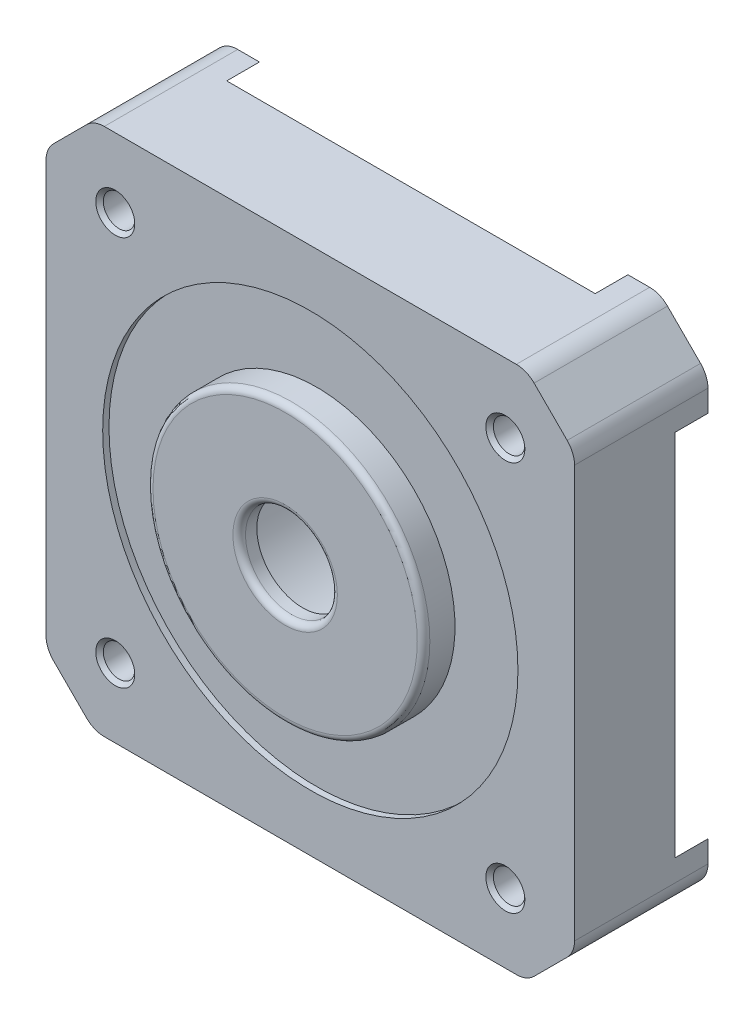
SolidWorks part; units mm, degrees
ref_plane "Front Plane" through (0, 0, 0) normal (0, 0, 1) x (1, 0, 0)
ref_plane "Top Plane" through (0, 0, 0) normal (0, 1, 0) x (1, 0, 0)
ref_plane "Right Plane" through (0, 0, 0) normal (1, 0, 0) x (0, 0, -1)
ref_plane "Plane1" through (0, 0, 34.2) normal (0, 0, -1) x (-1, 0, 0)
sketch "Sketch1" plane through (0, 0, 34.2) normal (0, 0, -1) x (-1, 0, 0)
  line L0 (27.5955, 125.6172) -> (-6.8045, 125.6172)
  line L1 (-6.8045, 125.6172) -> (-10.6045, 121.8172)
  line L2 (-10.6045, 121.8172) -> (-10.6045, 87.4172)
  line L3 (-10.6045, 87.4172) -> (-6.8045, 83.6172)
  line L4 (-6.8045, 83.6172) -> (27.5955, 83.6172)
  line L5 (27.5955, 83.6172) -> (31.3955, 87.4172)
  line L6 (31.3955, 87.4172) -> (31.3955, 121.8172)
  line L7 (31.3955, 121.8172) -> (27.5955, 125.6172)
extrude "Boss-Extrude1" add sketch "Sketch1" against normal blind 8
sketch "Sketch2" plane through (0, 0, 34.2) normal (0, 0, -1) x (-1, 0, 0)
  line L0 (-10.6045, 87.4172) -> (-10.6045, 89.9761)
  line L1 (-4.2455, 83.6172) -> (-6.8045, 83.6172)
  line L2 (-6.8045, 83.6172) -> (-10.6045, 87.4172)
  arc A0 (-10.6045, 89.9761) -> (-4.2455, 83.6172) centre (10.3955, 104.6172) ccw
extrude "Boss-Extrude2" add sketch "Sketch2" along normal blind 2.6
sketch "Sketch3" plane through (0, 0, 34.2) normal (0, 0, -1) x (-1, 0, 0)
  line L0 (27.5955, 83.6172) -> (25.0365, 83.6172)
  line L1 (31.3955, 89.9761) -> (31.3955, 87.4172)
  line L2 (31.3955, 87.4172) -> (27.5955, 83.6172)
  arc A0 (25.0365, 83.6172) -> (31.3955, 89.9761) centre (10.3955, 104.6172) ccw
extrude "Boss-Extrude3" add sketch "Sketch3" along normal blind 2.6
sketch "Sketch4" plane through (0, 0, 34.2) normal (0, 0, -1) x (-1, 0, 0)
  line L0 (31.3955, 121.8172) -> (31.3955, 119.2582)
  line L1 (25.0365, 125.6172) -> (27.5955, 125.6172)
  line L2 (27.5955, 125.6172) -> (31.3955, 121.8172)
  arc A0 (31.3955, 119.2582) -> (25.0365, 125.6172) centre (10.3955, 104.6172) ccw
extrude "Boss-Extrude4" add sketch "Sketch4" along normal blind 2.6
sketch "Sketch5" plane through (0, 0, 34.2) normal (0, 0, -1) x (-1, 0, 0)
  line L0 (-6.8045, 125.6172) -> (-4.2455, 125.6172)
  line L1 (-10.6045, 119.2582) -> (-10.6045, 121.8172)
  line L2 (-10.6045, 121.8172) -> (-6.8045, 125.6172)
  arc A0 (-4.2455, 125.6172) -> (-10.6045, 119.2582) centre (10.3955, 104.6172) ccw
extrude "Boss-Extrude5" add sketch "Sketch5" along normal blind 2.6
hole_wizard "M30 Clearance Hole1" positions "Sketch7" profile "Sketch6" hole size "M30" standard "ANSI Metric"
sketch "Sketch7" plane through (0, 0, 42.2) normal (0, 0, 1) x (1, 0, 0)
  point P0 (-10.3955, 104.6172)
sketch "Sketch6" plane through (-10.3955, 104.6172, 42.2) normal (1, 0, 0) x (0, -1, 0)
  line L0 (0, 0) -> (0, 10.6)
  line L1 (0, 10.6) -> (16.5, 10.6)
  line L2 (16.5, 10.6) -> (16.5, 0)
  line L5 (16.5, 0) -> (0, 0)
  line L11 (0, -6.35) -> (0, 107.95) construction
  dimension "Thru Hole Dia." = 33
  dimension "Thru Hole Depth" = 10.6
ref_plane "Plane2" through (0, 104.6172, 0) normal (0, -1, 0) x (1, 0, 0)
sketch "Sketch8" plane through (0, 104.6172, 0) normal (0, -1, 0) x (1, 0, 0)
  line L0 (0.6045, 44.2) -> (-10.3955, 44.2)
  line L1 (-10.3955, 44.2) -> (-10.3955, 41.7)
  line L2 (-10.3955, 41.7) -> (0.6045, 41.7)
  line L3 (0.6045, 41.7) -> (0.6045, 44.2)
  line L4 (-10.3955, 44.2) -> (-10.3955, 41.7) construction
revolve "Revolve1" add sketch "Sketch8" angle 360 about L4
sketch "Sketch12" plane through (0, 0, 41.7) normal (0, 0, -1) x (-1, 0, 0)
  circle A0 centre (10.3955, 104.6172) radius 8
  circle A1 centre (10.3955, 104.6172) radius 16.5
extrude "Boss-Extrude6" add sketch "Sketch12" along normal up to surface (7.5 mm away)
sketch "Sketch9" plane through (0, 104.6172, 0) normal (0, -1, 0) x (1, 0, 0)
  line L0 (-6.7455, 44.2) -> (-10.3955, 44.2)
  line L1 (-10.3955, 44.2) -> (-10.3955, 34.2)
  line L2 (-10.3955, 34.2) -> (-2.3955, 34.2)
  line L3 (-2.3955, 34.2) -> (-2.3955, 42.8)
  line L4 (-2.3955, 42.8) -> (-6.7455, 42.8)
  line L5 (-6.7455, 42.8) -> (-6.7455, 44.2)
  line L6 (-10.3955, 44.2) -> (-10.3955, 34.2) construction
revolve "Cut-Revolve1" cut sketch "Sketch9" angle 360 about L6
hole_wizard "Ø2.5 (2.5) Diameter Hole1" positions "Sketch11" profile "Sketch10" hole size "Ø2.5" standard "ANSI Metric"
sketch "Sketch11" plane through (0, 0, 42.2) normal (0, 0, 1) x (1, 0, 0)
  point P0 (5.1045, 89.1172)
  point P1 (5.1045, 120.1172)
  point P2 (-25.8955, 120.1172)
  point P3 (-25.8955, 89.1172)
sketch "Sketch10" plane through (5.1045, 89.1172, 42.2) normal (1, 0, 0) x (0, -1, 0)
  line L0 (0, 0) -> (0, 8)
  line L1 (0, 8) -> (1.25, 8)
  line L2 (1.25, 8) -> (1.25, 0)
  line L5 (1.25, 0) -> (0, 0)
  line L11 (0, -6.35) -> (0, 107.95) construction
  dimension "Thru Hole Dia." = 2.5
  dimension "Thru Hole Depth" = 8
fillet "Fillet1" radius 2 8 edges at (6.8045, 125.6172, 36.9) (-31.3955, 121.8172, 36.9) (-31.3955, 87.4172, 36.9) (10.6045, 87.4172, 36.9) (-27.5955, 125.6172, 36.9) (6.8045, 83.6172, 36.9) (-27.5955, 83.6172, 36.9) (10.6045, 121.8172, 36.9)
chamfer "Chamfer1" distance 0.3 angle 45 4 edges at (-24.6455, 120.1172, 42.2) (6.3545, 89.1172, 42.2) (-24.6455, 89.1172, 42.2) (6.3545, 120.1172, 42.2)
fillet "Fillet3" radius 0.5 2 edges at (-14.0455, 104.6172, 44.2) (-21.3955, 104.6172, 44.2)
